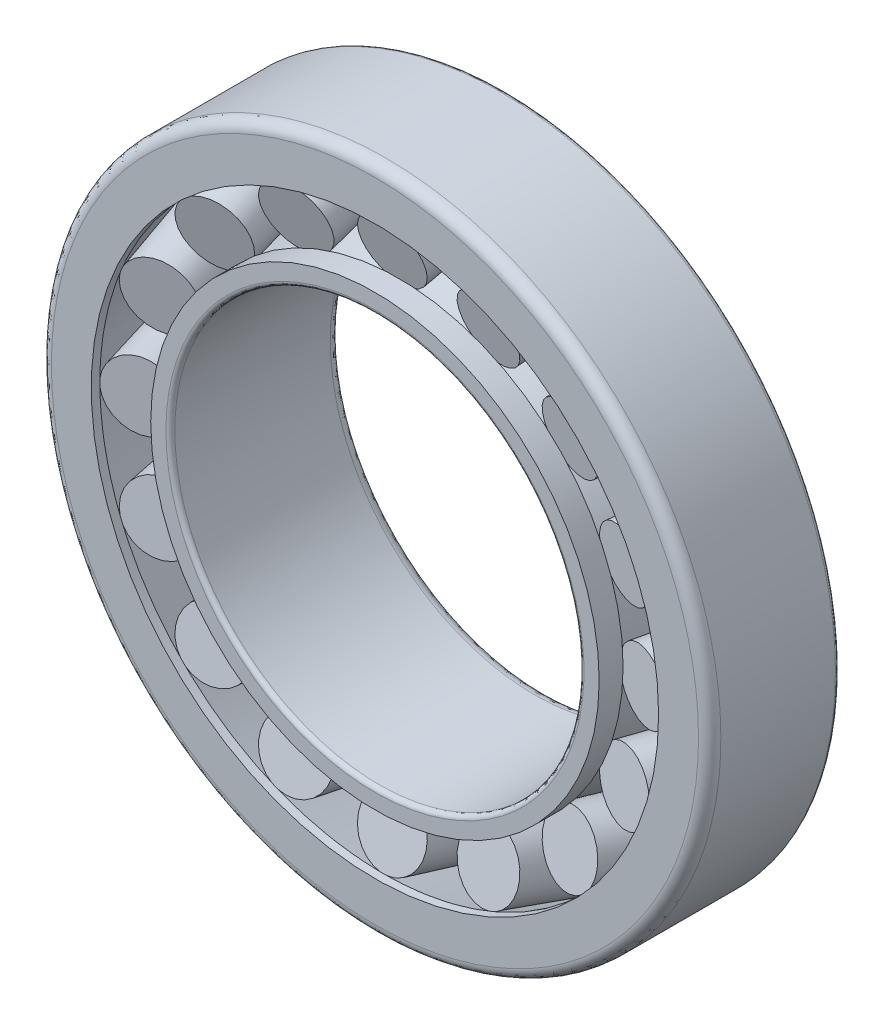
SolidWorks part; units mm, degrees
ref_plane "Front Plane" through (0, 0, 0) normal (0, 0, 1) x (1, 0, 0)
ref_plane "Top Plane" through (0, 0, 0) normal (0, 1, 0) x (1, 0, 0)
ref_plane "Right Plane" through (0, 0, 0) normal (1, 0, 0) x (0, 0, -1)
other "Configuration Table"
sketch "BaseSke" plane through (0, 0, 0) normal (1, 0, 0) x (0, 0, -1)
  line L0 (-47.2296, 0) -> (24.6132, 0) construction
  line L2 (0, 129.5214) -> (0, -86.3012) construction
  line L3 (8.6572, 41.7141) -> (-31.6572, 30.7859) construction
  line L4 (-23, 45) -> (-5.5, 45) construction
  line L5 (-23, 27.5) -> (0, 27.5) construction
  line L6 (-11.5, 36.25) -> (-18.5822, 62.3763) construction
  line L7 (-21.85, 38.1543) -> (-6.65, 42.705)
  line L8 (-6.65, 42.705) -> (-5.352, 37.9166)
  line L9 (-5.352, 37.9166) -> (-20.6606, 33.7668)
  line L10 (-20.6606, 33.7668) -> (-21.85, 38.1543)
  line L11 (-23, 45) -> (-23, 38.135) construction
  line L12 (-21.8448, 38.135) -> (-5.5, 43.0284) construction
  line L13 (-5.5, 45) -> (-5.5, 43.0284) construction
  line L14 (-21.8448, 38.135) -> (-23, 38.135) construction
  line L15 (-19.4713, 29.3792) -> (-4.054, 33.1282) construction
  line L16 (-23, 27.5) -> (-23, 30.1459) construction
  line L17 (-23, 30.1459) -> (-19.7827, 30.1459) construction
  line L18 (0, 33.8948) -> (0, 27.5) construction
  line L19 (-19.7827, 30.1459) -> (-19.5816, 29.4039) construction
  line L20 (-19.5816, 29.4039) -> (-3.9698, 33.2001) construction
  line L21 (-3.9698, 33.2001) -> (-4.1582, 33.8948) construction
  line L22 (-4.1582, 33.8948) -> (0, 33.8948) construction
revolve "Roller" add sketch "BaseSke" angle 360 about L3
sketch "OuterRaceSke" plane through (0, 0, 0) normal (1, 0, 0) x (0, 0, -1)
  line L0 (-21.8448, 38.135) -> (-23, 38.135) construction
  line L1 (-21.8448, 38.135) -> (-5.5, 43.0284) construction
  line L2 (-5.5, 45) -> (-5.5, 43.0284) construction
  line L3 (-23, 45) -> (-5.5, 45) construction
  line L4 (-23, 45) -> (-23, 38.135) construction
  line L5 (-21.8448, 38.135) -> (-23, 38.135)
  line L6 (-21.8448, 38.135) -> (-5.5, 43.0284)
  line L7 (-5.5, 45) -> (-5.5, 43.0284)
  line L8 (-23, 45) -> (-5.5, 45)
  line L9 (-23, 45) -> (-23, 38.135)
  line L10 (-60.3939, 0) -> (35.9926, 0) construction
revolve "OuterRace" add sketch "OuterRaceSke" angle 360 about L10
sketch "InnerRaceSke" plane through (0, 0, 0) normal (1, 0, 0) x (0, 0, -1)
  line L0 (-23, 27.5) -> (0, 27.5) construction
  line L1 (-23, 27.5) -> (-23, 30.1459) construction
  line L2 (-23, 30.1459) -> (-19.7827, 30.1459) construction
  line L3 (-19.7827, 30.1459) -> (-19.5816, 29.4039) construction
  line L4 (-19.5816, 29.4039) -> (-3.9698, 33.2001) construction
  line L5 (-3.9698, 33.2001) -> (-4.1582, 33.8948) construction
  line L6 (-4.1582, 33.8948) -> (0, 33.8948) construction
  line L7 (0, 33.8948) -> (0, 27.5) construction
  line L8 (-23, 27.5) -> (0, 27.5)
  line L9 (-23, 27.5) -> (-23, 30.1459)
  line L10 (-23, 30.1459) -> (-19.7827, 30.1459)
  line L11 (-19.7827, 30.1459) -> (-19.5816, 29.4039)
  line L12 (-19.5816, 29.4039) -> (-3.9698, 33.2001)
  line L13 (-3.9698, 33.2001) -> (-4.1582, 33.8948)
  line L14 (-4.1582, 33.8948) -> (0, 33.8948)
  line L15 (0, 33.8948) -> (0, 27.5)
  line L16 (-58.1022, 0) -> (39.538, 0) construction
revolve "InnerRace" add sketch "InnerRaceSke" angle 360 about L16
fillet "Fillet1" radius 0.6 2 edges at (45, 0, 5.5) (27.5, 0, 23)
fillet "InnerFillet" radius 1.5 1 edges at (27.5, 0, 0)
fillet "OuterFillet" radius 1.5 1 edges at (45, 0, 23)
pattern_circular "CirPatternBall" count 16 over 360 about axis through (0, 0, 0) along (0, 0, 1) of "Roller"
sketch "Sketch4" plane through (0, 0, 0) normal (1, 0, 0) x (0, 0, -1)
  line L0 (-21.85, 38.1543) -> (-6.65, 42.705)
  line L1 (-6.65, 42.705) -> (-4.054, 33.1282)
  line L2 (-4.054, 33.1282) -> (-19.4713, 29.3792)
  line L3 (-19.4713, 29.3792) -> (-21.85, 38.1543)
  line L4 (-40.3293, 0) -> (19.5574, 0) construction
revolve "Simplified" [suppressed] add sketch "Sketch4" angle 360 about L4
equation "\"D2@BaseSke\" = \"Bearing_Thickness@BaseSke\"/2"
equation "\"D3@BaseSke\" =  ( \"Bearing_Outside_Diameter@BaseSke\" + \"Bearing_Inside_Diameter@BaseSke\" )  / 2"
equation "\"Roller_diameter@BaseSke\" = \"D3@BaseSke\"*1.052"
equation "\"D4@BaseSke\" = \"Bearing_Thickness@BaseSke\"/20"
equation "\"D5@BaseSke\" = \"Bearing_Thickness@BaseSke\" / 20"
equation "\"D8@BaseSke\" = \"Bearing_Thickness@BaseSke\"/30"
equation "\"D11@BaseSke\" = \"D8@BaseSke\""
equation "\"D1@CirPatternBall\" = int(  \"D3@BaseSke\" *  pi  /  ( \"Bearing_Outside_Diameter@BaseSke\" - \"Bearing_Inside_Diameter@BaseSke\" )  * 2.5 ) "
